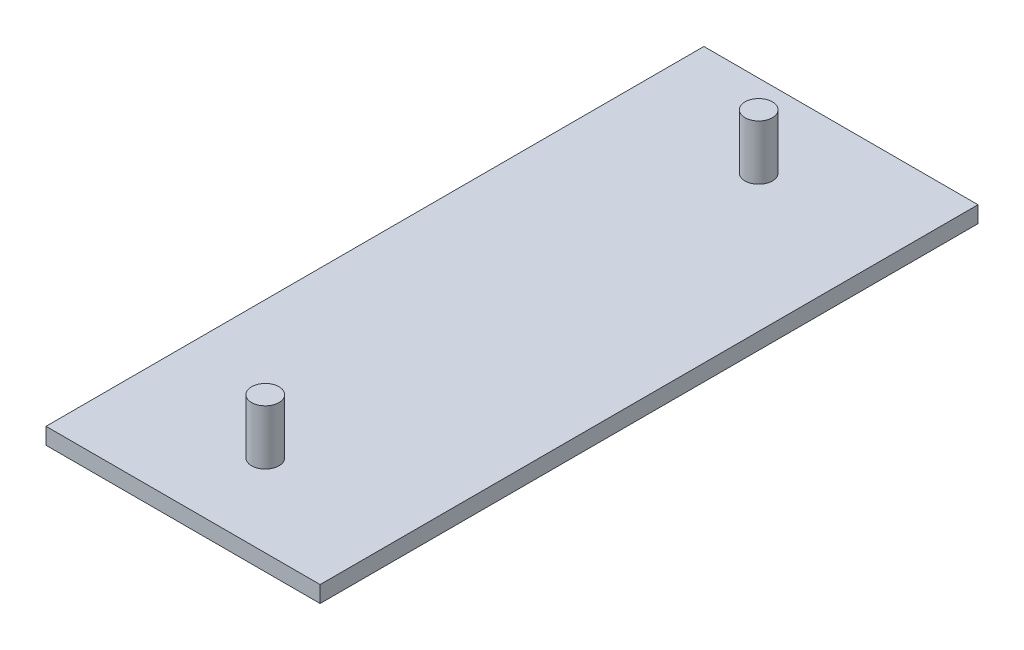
SolidWorks part; units mm, degrees
ref_plane "Plan de face" through (0, 0, 0) normal (0, 0, 1) x (1, 0, 0)
ref_plane "Plan de dessus" through (0, 0, 0) normal (0, 1, 0) x (1, 0, 0)
ref_plane "Plan de droite" through (0, 0, 0) normal (1, 0, 0) x (0, 0, -1)
sketch "Esquisse1" plane through (0, 0, 0) normal (0, 1, 0) x (1, 0, 0)
  line L1 (-25, 60) -> (25, 60)
  line L2 (-25, 60) -> (-25, -60)
  line L3 (-25, -60) -> (25, -60)
  line L4 (25, 60) -> (25, -60)
  line L5 (-25, 60) -> (25, -60) construction
  line L6 (-25, -60) -> (25, 60) construction
  point P0 (0, 0)
  dimension "D1" = 120
  dimension "D2" = 50
extrude "Extrusion1" add sketch "Esquisse1" along normal blind 3
sketch "Esquisse2" plane through (0, 3, 0) normal (0, 1, 0) x (1, 0, 0)
  line L0 (0, 45) -> (0, 0) construction
  line L1 (0, 0) -> (0, -45) construction
  circle A0 centre (0, 45) radius 2.5
  circle A1 centre (0, -45) radius 2.5
  point P0 (0, 0)
  dimension "D2" = 5
  dimension "D1" = 90
extrude "Extrusion2" add sketch "Esquisse2" along normal blind 10
